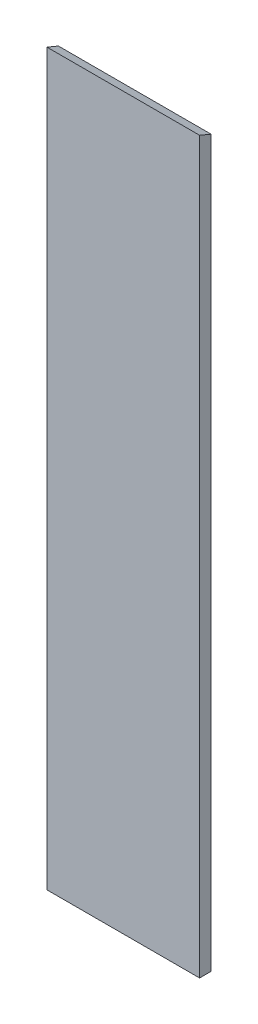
SolidWorks part; units mm, degrees
ref_plane "Plan de face" through (0, 0, 0) normal (0, 0, 1) x (1, 0, 0)
ref_plane "Plan de dessus" through (0, 0, 0) normal (0, 1, 0) x (1, 0, 0)
ref_plane "Plan de droite" through (0, 0, 0) normal (1, 0, 0) x (0, 0, -1)
sketch "Esquisse1" plane through (0, 0, 0) normal (0, 0, 1) x (1, 0, 0)
  line L1 (-100, -478.1) -> (100, -478.1)
  line L2 (-100, -478.1) -> (-100, 478.1)
  line L3 (-100, 478.1) -> (100, 478.1)
  line L4 (100, -478.1) -> (100, 478.1)
  line L5 (-100, -478.1) -> (100, 478.1) construction
  line L6 (-100, 478.1) -> (100, -478.1) construction
  point P0 (0, 0)
  dimension "D1" = 478.1
  dimension "D2" = 100
extrude "Boss.-Extru.1" add sketch "Esquisse1" along normal blind 15
sketch "Esquisse2" plane through (100, 0, 0) normal (1, 0, 0) x (0, 0, -1)
  line L0 (-15, 478.1) -> (0, 471.8868)
  line L1 (0, -478.1) -> (0, 478.1) construction
  line L2 (0, 471.8868) -> (0, 478.1)
  line L3 (0, 478.1) -> (-15, 478.1)
  dimension "D1" = 22.5
extrude "Enlèv. mat.-Extru.1" cut sketch "Esquisse2" against normal through all
